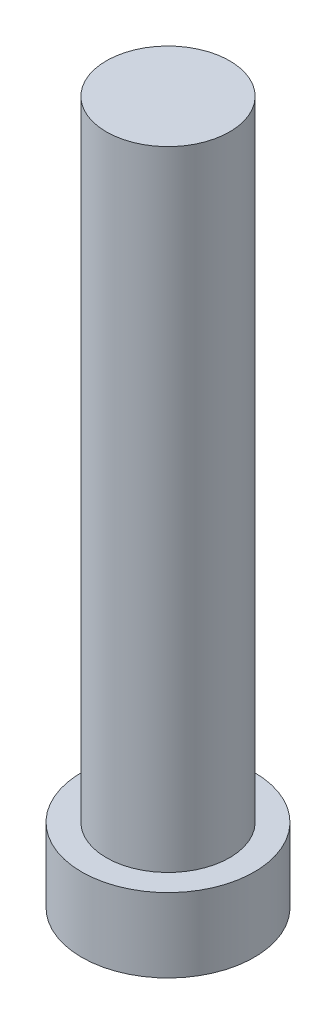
SolidWorks part; units mm, degrees
ref_plane "Face" through (0, 0, 0) normal (0, 0, 1) x (1, 0, 0)
ref_plane "Dessus" through (0, 0, 0) normal (0, 1, 0) x (1, 0, 0)
ref_plane "Droite" through (0, 0, 0) normal (1, 0, 0) x (0, 0, -1)
sketch "Esquisse1" plane through (0, 0, 0) normal (0, 0, 1) x (1, 0, 0)
  line L0 (0, 49.4323) -> (0, -48.5112) construction
  line L1 (0, 0) -> (-7, 0)
  line L2 (-7, 0) -> (-7, 6)
  line L3 (-7, 6) -> (-5, 6)
  line L4 (-5, 6) -> (-5, 62)
  line L5 (-5, 62) -> (0, 62)
  line L6 (0, 62) -> (0, 0)
  dimension "D1" = 62
  dimension "D2" = 6
  dimension "D3" = 14
  dimension "D4" = 5
revolve "Base-Révolution" add sketch "Esquisse1" angle 360 about L0
sketch "Esquisse2" plane through (0, 62, 0) normal (0, 1, 0) x (1, 0, 0)
  circle A0 centre (0, 0) radius 5 construction
  circle A1 centre (0, 0) radius 5
extrude "Enlèv. mat.-Extru.1" cut sketch "Esquisse2" against normal blind 5
